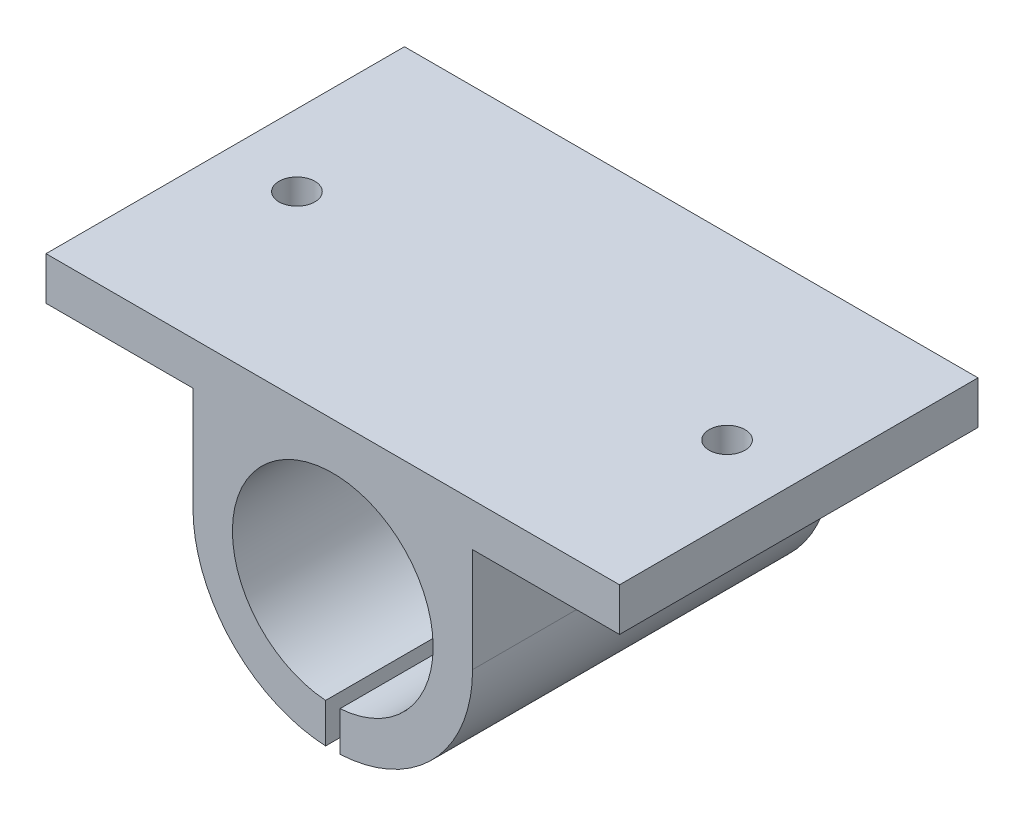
SolidWorks part; units mm, degrees
ref_plane "Alzado" through (0, 0, 0) normal (0, 0, 1) x (1, 0, 0)
ref_plane "Planta" through (0, 0, 0) normal (0, 1, 0) x (1, 0, 0)
ref_plane "Vista lateral" through (0, 0, 0) normal (1, 0, 0) x (0, 0, -1)
sketch "Croquis1" plane through (0, 0, 0) normal (0, 0, 1) x (1, 0, 0)
  line L0 (0, 0) -> (0, 10.25) construction
  line L1 (-20, 10.25) -> (20, 10.25)
  line L2 (-20, 10.25) -> (-20, 7.25)
  line L3 (-20, 7.25) -> (-9.75, 7.25)
  line L4 (20, 10.25) -> (20, 7.25)
  line L5 (-9.75, 0) -> (-9.75, 7.25)
  line L6 (9.75, 0) -> (9.75, 7.25)
  line L7 (0, -4.1284) -> (0, 0.4561) construction
  line L9 (0.5, -6.9821) -> (0.5, -9.7372)
  line L11 (-0.5, -6.9821) -> (-0.5, -9.7372)
  line L12 (9.75, 7.25) -> (20, 7.25)
  arc A0 (0.5, -6.9821) -> (-0.5, -6.9821) centre (0, 0) ccw
  arc A1 (0.5, -9.7372) -> (9.75, 0) centre (0, 0) ccw
  arc A2 (-9.75, 0) -> (-0.5, -9.7372) centre (0, 0) ccw
  dimension "D1" = 14
  dimension "D2" = 19.5
  dimension "D3" = 3
  dimension "D4" = 40
  dimension "D5" = 10.25
  dimension "D6" = 1
  dimension "D7" = 0.5
extrude "Saliente-Extruir1" add sketch "Croquis1" along normal blind 25
sketch "Croquis2" plane through (0, 10.25, 0) normal (0, 1, 0) x (1, 0, 0)
  line L0 (-15, -12.5) -> (15, -12.5) construction
  line L1 (0, -12.5) -> (0, 0) construction
  line L2 (20, 0) -> (-20, 0) construction
  line L3 (0, -12.5) -> (0, -25) construction
  line L4 (20, -25) -> (-20, -25) construction
  circle A0 centre (-15, -12.5) radius 1.25
  circle A1 centre (15, -12.5) radius 1.25
  dimension "D1" = 30
  dimension "D2" = 2.5
extrude "Cortar-Extruir1" cut sketch "Croquis2" against normal blind 12
